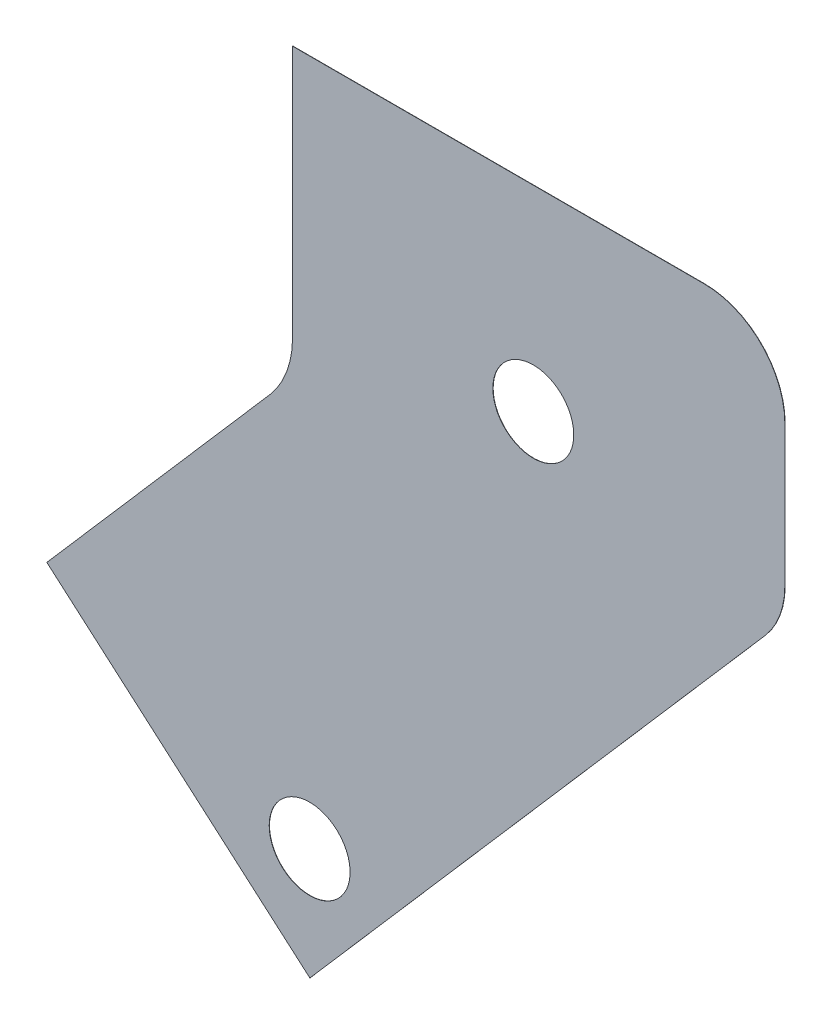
SolidWorks part; units mm, degrees
ref_plane "Front" through (0, 0, 0) normal (0, 0, 1) x (1, 0, 0)
ref_plane "Top" through (0, 0, 0) normal (0, 1, 0) x (1, 0, 0)
ref_plane "Right" through (0, 0, 0) normal (1, 0, 0) x (0, 0, -1)
sketch "Sketch1" plane through (0, 0, 0) normal (0, 0, 1) x (1, 0, 0)
  line L12 (-661.5398, -84.1406) -> (-621.3752, -37.891)
  line L13 (-684.7449, -63.9886) -> (-661.5398, -84.1406)
  line L14 (-665.0581, -41.3192) -> (-684.7449, -63.9886)
  line L15 (-663.067, -13.7079) -> (-663.067, -35.9898)
  line L16 (-626.745, -13.7079) -> (-663.067, -13.7079)
  line L17 (-619.633, -33.2277) -> (-619.633, -20.8199)
  line L18 (-661.5398, -84.1406) -> (-621.3752, -37.891)
  line L19 (-684.7449, -63.9886) -> (-661.5398, -84.1406)
  line L20 (-665.0581, -41.3192) -> (-684.7449, -63.9886)
  line L21 (-663.067, -13.7079) -> (-663.067, -35.9898)
  line L22 (-626.745, -13.7079) -> (-663.067, -13.7079)
  line L23 (-619.633, -33.2277) -> (-619.633, -20.8199)
  arc A6 (-665.0581, -41.3192) -> (-663.067, -35.9898) centre (-671.195, -35.9898) ccw
  arc A7 (-619.633, -20.8199) -> (-626.745, -13.7079) centre (-626.745, -20.8199) ccw
  arc A8 (-621.3752, -37.891) -> (-619.633, -33.2277) centre (-626.745, -33.2277) ccw
  arc A9 (-665.0581, -41.3192) -> (-663.067, -35.9898) centre (-671.195, -35.9898) ccw
  arc A10 (-619.633, -20.8199) -> (-626.745, -13.7079) centre (-626.745, -20.8199) ccw
  arc A11 (-621.3752, -37.891) -> (-619.633, -33.2277) centre (-626.745, -33.2277) ccw
  dimension "D1" = 0.508
extrude "Boss-Extrude1" add sketch "Sketch1" along normal blind 0.0254 separate body
hole_wizard "Hole1" positions "Point_Sketch" profile "Profil_Sketch" hole size "Ø0.15" standard "ISO"
sketch "Point_Sketch" plane through (-638.1715, -20.035, 0) normal (0, 0, 1) x (-1, 0, 0)
  point P0 (3.6543, 10.9736)
  point P2 (23.3871, 54.2492)
sketch "Profil_Sketch" plane through (-641.8258, -31.0086, 0) normal (1, 0, 0) x (0, 1, 0)
  line L0 (0, 0) -> (0, 0.0254)
  line L1 (0, 0.0254) -> (3.5687, 0.0254)
  line L2 (3.5687, 0.0254) -> (3.5687, 0)
  line L5 (3.5687, 0) -> (0, 0)
  line L11 (0, -6.35) -> (0, 107.95) construction
  dimension "Diameter" = 7.1374
  dimension "Thru Hole Depth" = 0.0254
other "usin_DL090_.25-20x3-SHCS<1>"
